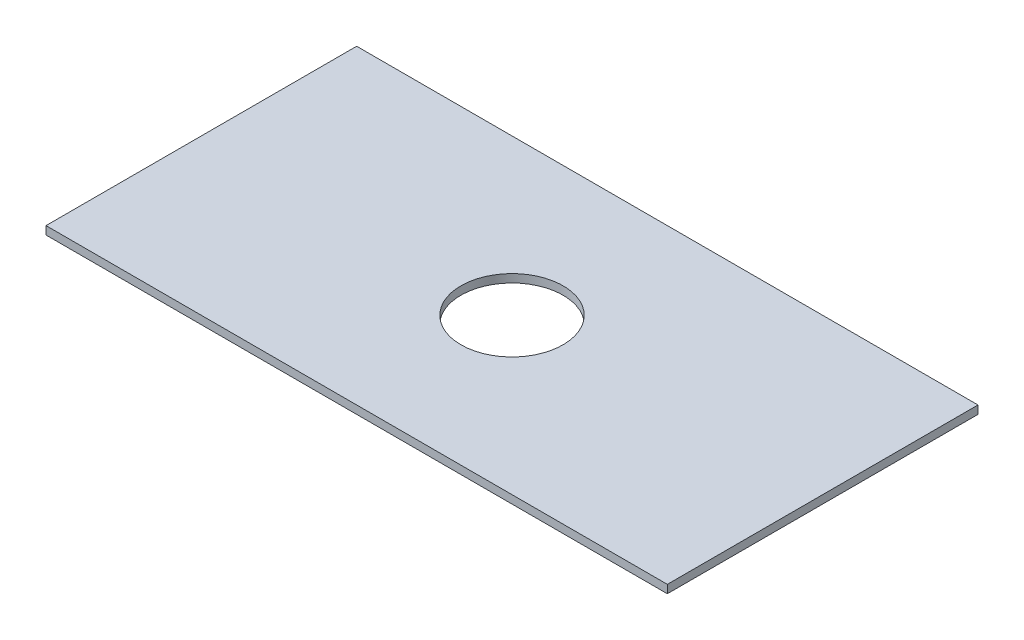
SolidWorks part; units mm, degrees
ref_plane "Front Plane" through (0, 0, 0) normal (0, 0, 1) x (1, 0, 0)
ref_plane "Top Plane" through (0, 0, 0) normal (0, 1, 0) x (1, 0, 0)
ref_plane "Right Plane" through (0, 0, 0) normal (1, 0, 0) x (0, 0, -1)
sketch "Sketch1" plane through (0, 0, 0) normal (0, 1, 0) x (1, 0, 0)
  line L0 (124.9213, 0) -> (-121.4745, 0) construction
  line L1 (-152, 76) -> (152, 76)
  line L2 (-152, 76) -> (-152, -76)
  line L3 (-152, -76) -> (152, -76)
  line L4 (152, 76) -> (152, -76)
  line L5 (0, 56.9494) -> (0, -49.4084) construction
  dimension "D1" = 304
  dimension "D2" = 152
extrude "Boss-Extrude2" add sketch "Sketch1" along normal blind 4
sketch "Sketch2" plane through (0, 4, 0) normal (0, 1, 0) x (1, 0, 0)
  circle A0 centre (0, 0) radius 25
  dimension "D1" = 50
extrude "Cut-Extrude1" cut sketch "Sketch2" against normal blind 10
ref_point "Point2"
ref_point "Point3"
